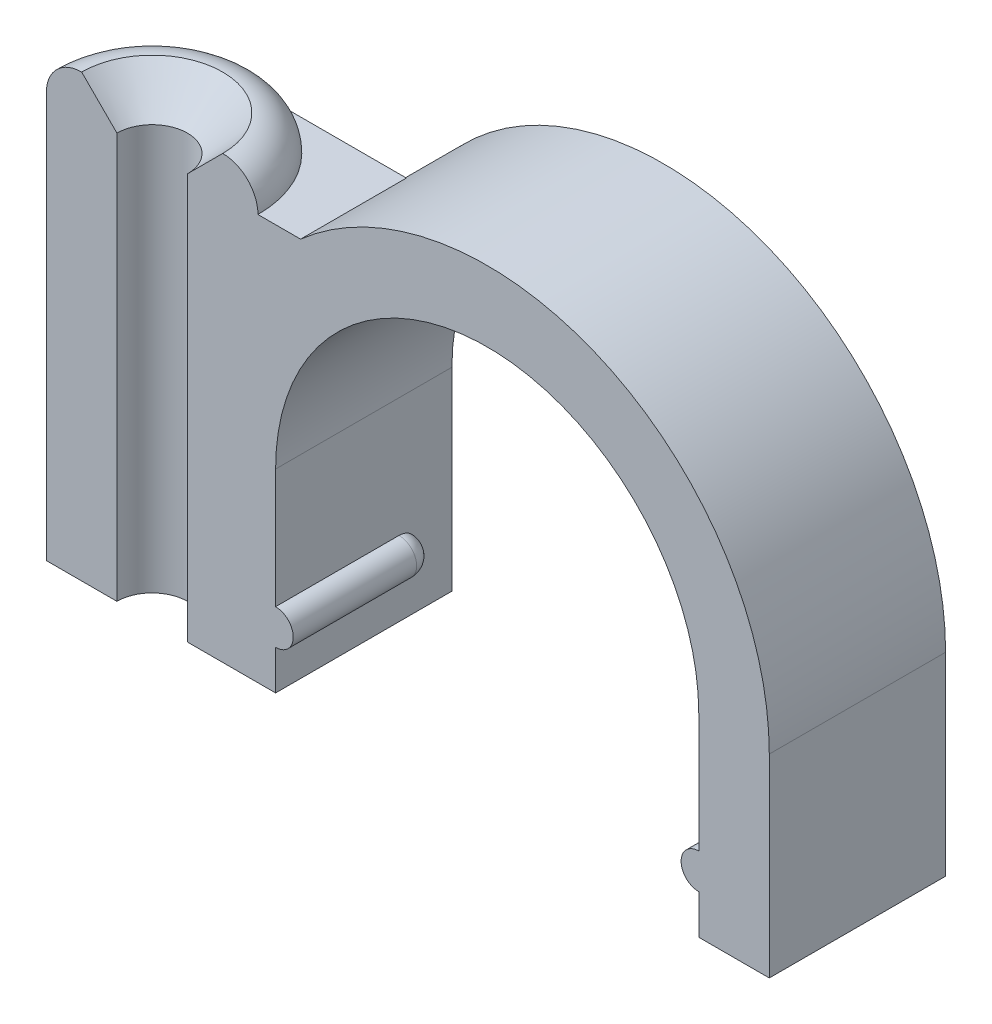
SolidWorks part; units mm, degrees
ref_plane "face" through (0, 0, 0) normal (0, 0, 1) x (1, 0, 0)
ref_plane "dessus" through (0, 0, 0) normal (0, 1, 0) x (1, 0, 0)
ref_plane "profil" through (0, 0, 0) normal (1, 0, 0) x (0, 0, -1)
sketch "Esquisse1" plane through (0, 0, 0) normal (0, 0, 1) x (1, 0, 0)
  line L0 (14, 0) -> (14, 5.5)
  line L1 (2, 0) -> (2, 5.5)
  line L2 (0, 0) -> (0, 5.5)
  line L3 (0, 0) -> (2, 0)
  line L4 (16, 0) -> (16, 5.5)
  line L5 (14, 0) -> (16, 0)
  arc A0 (0, 5.5) -> (16, 5.5) centre (8, 5.5) cw
  arc A1 (2, 5.5) -> (14, 5.5) centre (8, 5.5) cw
  dimension "D4" = 2
  dimension "D3" = 5.5
  dimension "D1" = 16
  dimension "D2" = 5.5
extrude "Base-Extrusion" add sketch "Esquisse1" against normal blind 10
sketch "Esquisse10" plane through (0, 0, 0) normal (0, -1, 0) x (1, 0, 0)
  line L0 (14, 0) -> (2, 0) construction
  line L1 (2, -10) -> (2, 0) construction
  circle A0 centre (-1.5, -5) radius 3
  dimension "D1" = 6
  dimension "D2" = 5
  dimension "D3" = 3.5
extrude "Boss.-Extru.5" add sketch "Esquisse10" against normal blind 12.5
ref_plane "Plan1" through (-1.5, 0, 0) normal (1, 0, 0) x (0, 0, -1)
sketch "Esquisse4" plane through (-1.5, 0, 0) normal (1, 0, 0) x (0, 0, -1)
  line L0 (10, 5.5) -> (10, 0) construction
  line L1 (8, 0) -> (2, 0)
  line L2 (8, 0) -> (8, 11.5)
  line L3 (8, 11.5) -> (2, 11.5)
  line L4 (2, 0) -> (2, 11.5)
  dimension "D1" = 11.5
  dimension "D2" = 6
  dimension "D3" = 2
extrude "Boss.-Extru.3" add sketch "Esquisse4" along normal up to next
ref_plane "Plan2" through (0, 0, -5) normal (0, 0, 1) x (1, 0, 0)
fillet "Congé3" radius 1
hole_wizard "Perçage1" positions "Esquisse12" profile "Esquisse11" countersink size "M2" standard "Ansi Métrique"
sketch "Esquisse12" plane through (0, 12.5, 0) normal (0, 1, 0) x (-1, 0, 0)
  point P0 (1.5, -5)
sketch "Esquisse11" plane through (-1.5, 12.5, -5) normal (1, 0, 0) x (0, 0, 1)
  line L0 (0, 0) -> (0, 12.5)
  line L1 (0, 12.5) -> (1, 12.5)
  line L2 (1, 12.5) -> (1, 1)
  line L3 (1, 1) -> (2, 0)
  line L5 (2, 0) -> (0, 0)
  line L6 (-1, 1) -> (-2, 0) construction
  line L11 (0, -6.35) -> (0, 107.95) construction
  dimension "Diamètre du perçage jusqu'au prochain" = 2
  dimension "Profondeur du perçage jusqu'au prochain" = 12.5
  dimension "Diamètre du fraisage entrant" = 4
  dimension "Angle du fraisage entrant" = 90
sketch "Esquisse9" plane through (0, 0, -5) normal (0, 0, 1) x (1, 0, 0)
  line L4 (2, 0) -> (2, 5.5) construction
  line L6 (2, 2.1191) -> (2, 1.1191)
  arc A0 (2, 1.1191) -> (2, 2.1191) centre (2, 1.6191) ccw
  dimension "D1" = 1
extrude "Boss.-Extru.4" add sketch "Esquisse9" along normal mid plane 8
fillet "Congé5" radius 0.5
ref_plane "Plan3" through (8, 0, 0) normal (-1, 0, 0) x (0, 0, 1)
mirror "Symétrie1" about plane through (8, 0, 0) normal (-1, 0, 0)
sketch "Esquisse13" plane through (0, 0, -5) normal (0, 0, 1) x (1, 0, 0)
  line L1 (-5.4623, -0.7543) -> (16.874, -0.7543)
  line L2 (-5.4623, -0.7543) -> (-5.4623, 13.9012)
  line L3 (-5.4623, 13.9012) -> (16.874, 13.9012)
  line L4 (16.874, -0.7543) -> (16.874, 13.9012)
extrude "Enlèv. mat.-Extru.1" cut sketch "Esquisse13" along normal up to next
